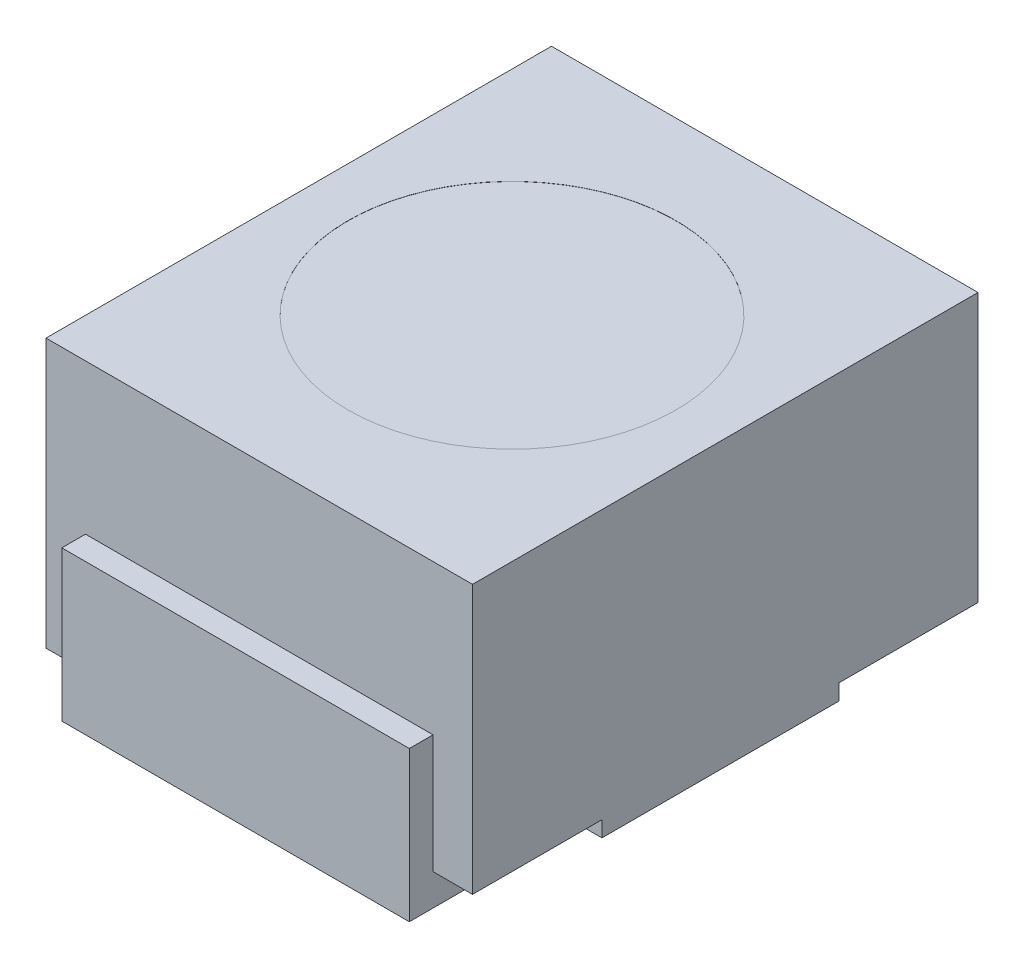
SolidWorks part; units mm, degrees
ref_plane "Front Plane" through (0, 0, 0) normal (0, 0, 1) x (1, 0, 0)
ref_plane "Top Plane" through (0, 0, 0) normal (0, 1, 0) x (1, 0, 0)
ref_plane "Right Plane" through (0, 0, 0) normal (1, 0, 0) x (0, 0, -1)
sketch "Sketch1" plane through (0, 0, 0) normal (0, 1, 0) x (1, 0, 0)
  line L1 (-1.35, -1.6) -> (1.35, -1.6)
  line L2 (-1.35, -1.6) -> (-1.35, 1.6)
  line L3 (-1.35, 1.6) -> (1.35, 1.6)
  line L4 (1.35, -1.6) -> (1.35, 1.6)
  line L5 (-1.35, -1.6) -> (1.35, 1.6) construction
  line L6 (-1.35, 1.6) -> (1.35, -1.6) construction
  point P0 (0, 0)
  dimension "D1" = 2.7
  dimension "D2" = 3.2
extrude "Boss-Extrude1" add sketch "Sketch1" along normal blind 1.9
sketch "Sketch4" plane through (0, 0, 0) normal (0, -1, 0) x (1, 0, 0)
  line L1 (-1.1, 1.75) -> (1.1, 1.75)
  line L2 (-1.1, 1.75) -> (-1.1, 1.6)
  line L3 (-1.1, 1.6) -> (1.1, 1.6)
  line L4 (1.1, 1.75) -> (1.1, 1.6)
  line L5 (-1.1, -1.6) -> (1.1, -1.6)
  line L6 (-1.1, -1.6) -> (-1.1, -1.75)
  line L7 (-1.1, -1.75) -> (1.1, -1.75)
  line L8 (1.1, -1.6) -> (1.1, -1.75)
extrude "Boss-Extrude3" add sketch "Sketch4" against normal blind 0.95
sketch "Sketch5" plane through (0, 0, 0) normal (0, -1, 0) x (1, 0, 0)
  line L0 (-1.35, -1.6) -> (-1.35, 1.6) construction
  line L1 (-1.35, 1.3971) -> (1.35, 1.3971)
  line L2 (-1.35, 1.3971) -> (-1.35, -1.4313)
  line L3 (-1.35, -1.4313) -> (1.35, -1.4313)
  line L4 (1.35, 1.3971) -> (1.35, -1.4313)
  line L5 (1.35, 1.6) -> (1.35, -1.6) construction
extrude "Cut-Extrude1" cut sketch "Sketch5" against normal blind 0.2
sketch "Sketch6" plane through (0, 0.2, 0) normal (0, -1, 0) x (1, 0, 0)
  line L0 (-1.35, 1.3971) -> (-1.35, -1.4313) construction
  line L1 (-1.35, 0.7807) -> (1.35, 0.7807)
  line L2 (-1.35, 0.7807) -> (-1.35, -0.7193)
  line L3 (-1.35, -0.7193) -> (1.35, -0.7193)
  line L4 (1.35, 0.7807) -> (1.35, -0.7193)
  line L5 (1.35, -1.4313) -> (1.35, 1.3971) construction
  dimension "D1" = 1.5
extrude "Boss-Extrude4" add sketch "Sketch6" along normal blind 0.1
sketch "Sketch7" plane through (0, 0.2, 0) normal (0, -1, 0) x (1, 0, 0)
  line L1 (-1.1, 1.6) -> (-1.4324, 1.6)
  line L2 (-1.1, 1.6) -> (-1.1, 1.3069)
  line L3 (-1.1, 1.3069) -> (-1.4324, 1.3069)
  line L4 (-1.4324, 1.6) -> (-1.4324, 1.3069)
  line L5 (1.1, 1.6) -> (1.6379, 1.6)
  line L6 (1.1, 1.6) -> (1.1, 1.2384)
  line L7 (1.1, 1.2384) -> (1.6379, 1.2384)
  line L8 (1.6379, 1.6) -> (1.6379, 1.2384)
  line L9 (-1.35, -1.6) -> (-1.1, -1.6)
  line L10 (-1.35, -1.6) -> (-1.35, -1.2099)
  line L11 (-1.35, -1.2099) -> (-1.1, -1.2099)
  line L12 (-1.1, -1.6) -> (-1.1, -1.2099)
  line L13 (1.1, -1.6) -> (1.5637, -1.6)
  line L14 (1.1, -1.6) -> (1.1, -1.2099)
  line L15 (1.1, -1.2099) -> (1.5637, -1.2099)
  line L16 (1.5637, -1.6) -> (1.5637, -1.2099)
extrude "Cut-Extrude3" cut sketch "Sketch7" along normal through all
sketch "Sketch8" plane through (0, 0.2, 0) normal (0, -1, 0) x (1, 0, 0)
  line L0 (1.1, 1.6) -> (1.1, 1.3971) construction
  line L1 (-1.1, 1.3971) -> (1.1, 1.3971)
  line L2 (-1.1, 1.3971) -> (-1.1, 0.9416)
  line L3 (-1.1, 0.9416) -> (1.1, 0.9416)
  line L4 (1.1, 1.3971) -> (1.1, 0.9416)
  line L6 (-1.1, -1.4313) -> (1.1, -1.4313)
  line L7 (-1.1, -1.4313) -> (-1.1, -0.856)
  line L8 (-1.1, -0.856) -> (1.1, -0.856)
  line L9 (1.1, -1.4313) -> (1.1, -0.856)
extrude "Boss-Extrude5" add sketch "Sketch8" along normal up to surface (0.2 mm away)
sketch "Sketch9" plane through (0, 1.9, 0) normal (0, 1, 0) x (1, 0, 0)
  circle A0 centre (0, 0) radius 1.0382
extrude "Cut-Extrude4" cut sketch "Sketch9" against normal blind 0.001
